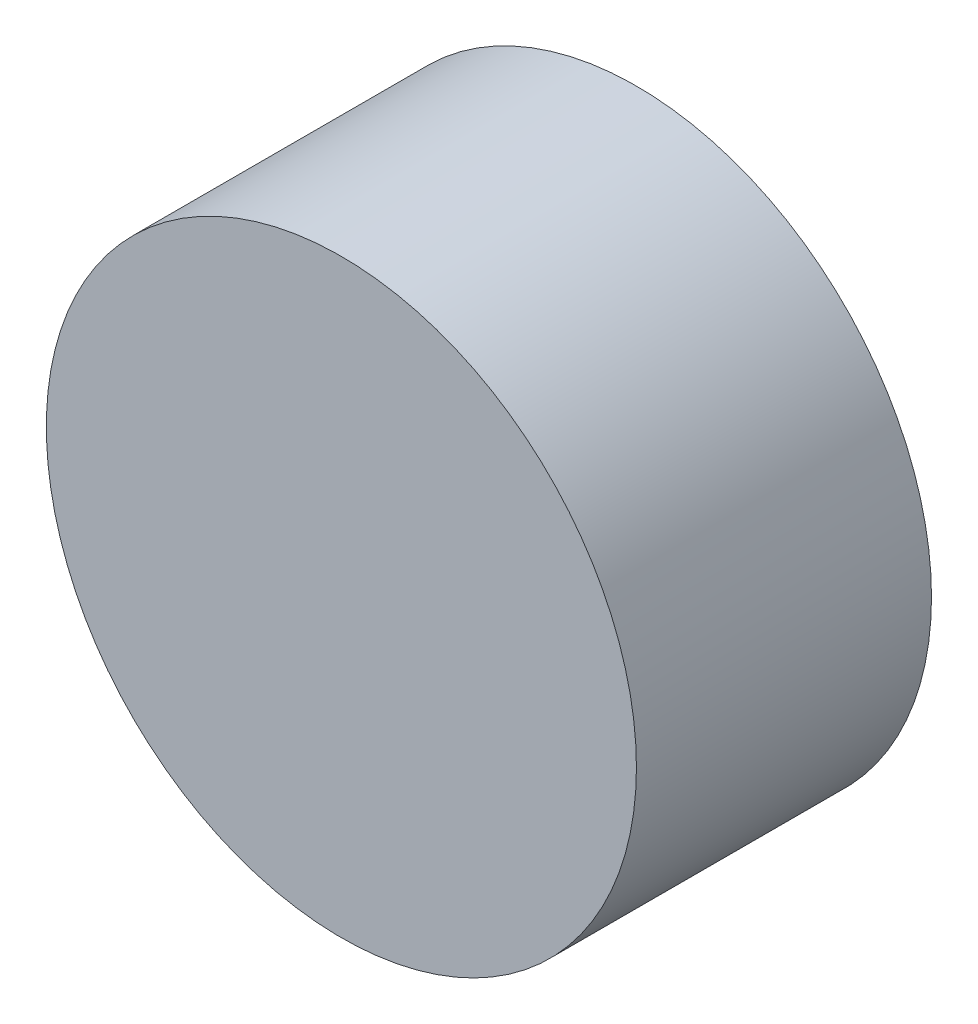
SolidWorks part; units mm, degrees
ref_plane "Ebene vorne" through (0, 0, 0) normal (0, 0, 1) x (1, 0, 0)
ref_plane "Ebene oben" through (0, 0, 0) normal (0, 1, 0) x (1, 0, 0)
ref_plane "Ebene rechts" through (0, 0, 0) normal (1, 0, 0) x (0, 0, -1)
sketch "Skizze1" plane through (0, 0, 0) normal (0, 0, 1) x (1, 0, 0)
  circle A0 centre (0, 0) radius 5
  dimension "D1" = 10
extrude "Linear austragen1" add sketch "Skizze1" along normal blind 5
